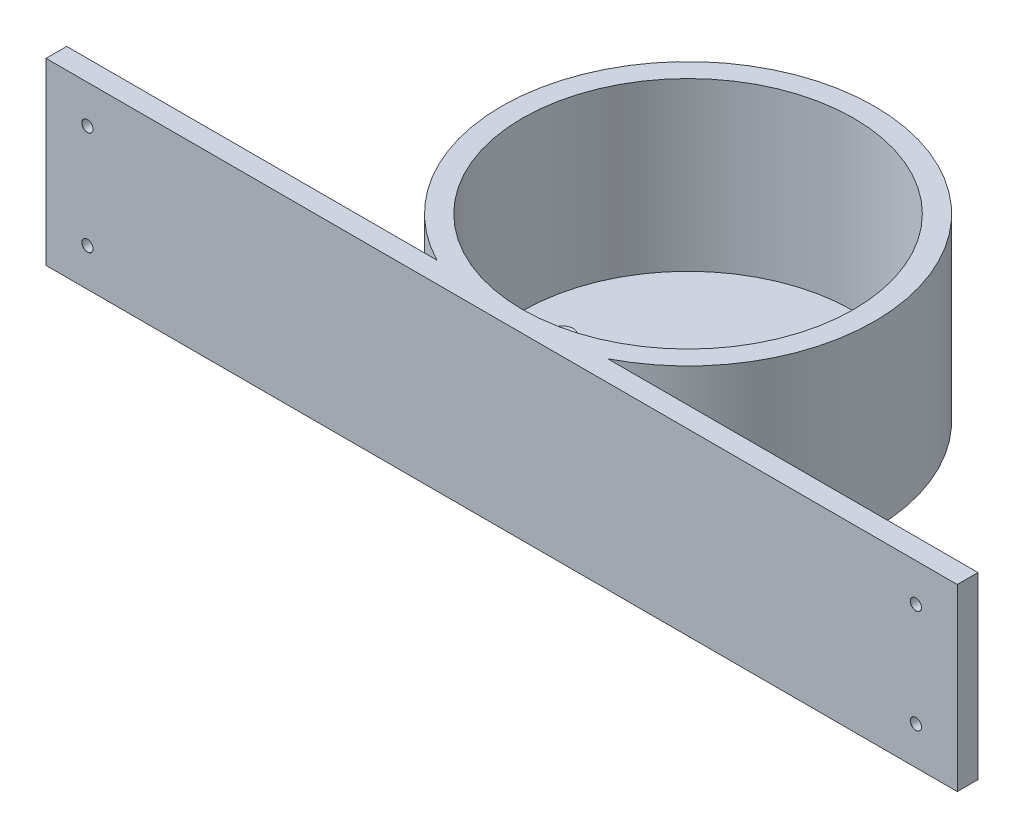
SolidWorks part; units mm, degrees
ref_plane "Front Plane" through (0, 0, 0) normal (0, 0, 1) x (1, 0, 0)
ref_plane "Top Plane" through (0, 0, 0) normal (0, 1, 0) x (1, 0, 0)
ref_plane "Right Plane" through (0, 0, 0) normal (1, 0, 0) x (0, 0, -1)
sketch "Sketch2" plane through (0, 0, 0) normal (0, 1, 0) x (1, 0, 0)
  circle A0 centre (0, 0) radius 57.15
  dimension "D1" = 114.3
extrude "Boss-Extrude1" add sketch "Sketch2" along normal blind 3.81
sketch "Sketch3" plane through (0, 3.81, 0) normal (0, 1, 0) x (1, 0, 0)
  circle A0 centre (0, 0) radius 57.15
  circle A1 centre (0, 0) radius 57.15 construction
  circle A2 centre (0, 0) radius 50.8
  dimension "D1" = 101.6
extrude "Boss-Extrude2" add sketch "Sketch3" along normal blind 51.181
sketch "Sketch4" plane through (0, 0, 0) normal (0, -1, 0) x (1, 0, 0)
  line L1 (-6.604, 5.588) -> (6.604, 5.588)
  line L2 (-6.604, 5.588) -> (-6.604, -5.588)
  line L3 (-6.604, -5.588) -> (6.604, -5.588)
  line L4 (6.604, 5.588) -> (6.604, -5.588)
  line L5 (-6.604, 5.588) -> (6.604, -5.588) construction
  line L6 (-6.604, -5.588) -> (6.604, 5.588) construction
  point P0 (0, 0)
  dimension "D1" = 11.176
  dimension "D2" = 13.208
extrude "Cut-Extrude1" cut sketch "Sketch4" against normal through all and the other way through all
hole_wizard "CSK for M3 Flat Head Machine Screw1" positions "Sketch6" profile "Sketch7" countersink size "M3" standard "ANSI Metric"
sketch "Sketch6" plane through (0, 3.81, 0) normal (0, 1, 0) x (1, 0, 0)
  line L1 (0, 19.0298) -> (0, -20.4469) construction
  line L3 (-6.604, 5.588) -> (-6.604, -5.588) construction
  point P12 (38.354, 0)
  point P14 (-38.354, 0)
  dimension "D2" = 31.75
sketch "Sketch7" plane through (-38.354, 3.81, 0) normal (1, 0, 0) x (0, 0, 1)
  line L0 (0, 0) -> (0, 3.81)
  line L1 (0, 3.81) -> (1.725, 3.81)
  line L2 (1.7, 3.785) -> (1.7, 1.45)
  line L3 (1.7, 1.45) -> (3.15, 0)
  line L5 (3.15, 0) -> (0, 0)
  line L6 (-1.7, 1.45) -> (-3.15, 0) construction
  line L7 (1.725, 3.81) -> (1.7, 3.785)
  line L8 (-1.725, 3.81) -> (-1.7, 3.785) construction
  line L11 (0, -6.35) -> (0, 107.95) construction
  dimension "Thru Hole Dia." = 3.4
  dimension "Thru Hole Depth" = 3.81
  dimension "Near C'Sink Dia." = 6.3
  dimension "Near C'Sink Angle" = 90
  dimension "Far C'Sink Dia." = 3.45
  dimension "Far C'Sink Angle" = 90
ref_plane "Plane1" through (0, 0, 50.8) normal (0, 0, -1) x (-1, 0, 0)
sketch "Sketch9" plane through (0, 0, 50.8) normal (0, 0, -1) x (-1, 0, 0)
  line L0 (-139.7, 0) -> (139.7, 0)
  line L1 (-57.15, 0) -> (57.15, 0) construction
  line L2 (139.7, 0) -> (139.7, 54.991)
  line L3 (139.7, 54.991) -> (-139.7, 54.991)
  line L4 (-139.7, 54.991) -> (-139.7, 0)
  line L7 (0, 0) -> (0, 42.5727) construction
  dimension "D1" = 54.991
  dimension "D2" = 279.4
extrude "Boss-Extrude4" add sketch "Sketch9" against normal blind 6.35
hole_wizard "CSK for M3 Flat Head Machine Screw2" positions "Sketch10" profile "Sketch11" countersink size "M3" standard "ANSI Metric"
sketch "Sketch10" plane through (0, 0, 50.8) normal (0, 0, -1) x (-1, 0, 0)
  line L0 (0, 0) -> (0, 38.2356) construction
  line L2 (139.7, 27.4955) -> (93.6723, 27.4955) construction
  line L3 (139.7, 0) -> (139.7, 54.991) construction
  point P0 (-127, 43.3705)
  point P2 (-127, 11.6205)
  point P4 (127, 43.3705)
  point P6 (127, 11.6205)
  point P29 (0, 0)
  dimension "D1" = 127
  dimension "D2" = 31.75
sketch "Sketch11" plane through (127, 43.3705, 50.8) normal (1, 0, 0) x (0, 1, 0)
  line L0 (0, 0) -> (0, 6.35)
  line L1 (0, 6.35) -> (1.725, 6.35)
  line L2 (1.7, 6.325) -> (1.7, 1.45)
  line L3 (1.7, 1.45) -> (3.15, 0)
  line L5 (3.15, 0) -> (0, 0)
  line L6 (-1.7, 1.45) -> (-3.15, 0) construction
  line L7 (1.725, 6.35) -> (1.7, 6.325)
  line L8 (-1.725, 6.35) -> (-1.7, 6.325) construction
  line L11 (0, -6.35) -> (0, 107.95) construction
  dimension "Thru Hole Dia." = 3.4
  dimension "Thru Hole Depth" = 6.35
  dimension "Near C'Sink Dia." = 6.3
  dimension "Near C'Sink Angle" = 90
  dimension "Far C'Sink Dia." = 3.45
  dimension "Far C'Sink Angle" = 90
